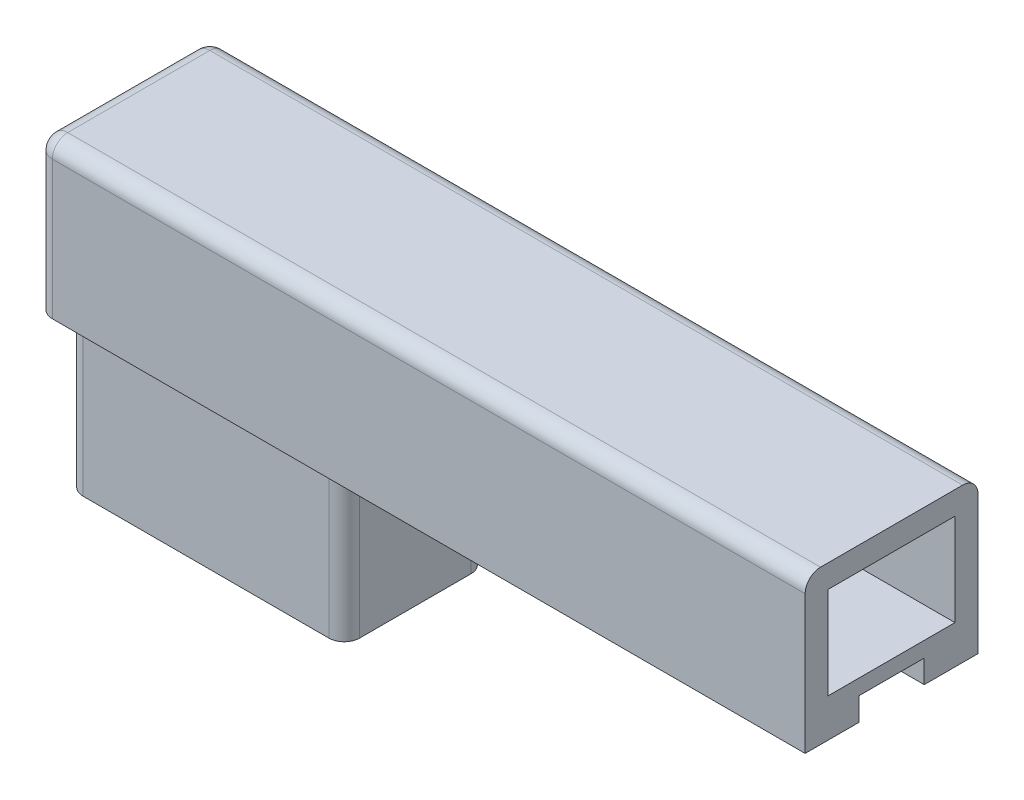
SolidWorks part; units mm, degrees
ref_plane "Ebene vorne" through (0, 0, 0) normal (0, 0, 1) x (1, 0, 0)
ref_plane "Ebene oben" through (0, 0, 0) normal (0, 1, 0) x (1, 0, 0)
ref_plane "Ebene rechts" through (0, 0, 0) normal (1, 0, 0) x (0, 0, -1)
sketch "Skizze1" plane through (0, 0, 0) normal (0, 1, 0) x (1, 0, 0)
  line L1 (160, -22.5) -> (-40, -22.5)
  line L2 (160, -22.5) -> (160, 22.5)
  line L3 (160, 22.5) -> (-40, 22.5)
  line L4 (-40, -22.5) -> (-40, 22.5)
  point P0 (0, 0)
  point P6 (-40, 0)
  dimension "D1" = 45
  dimension "D2" = 200
  dimension "D3" = 40
extrude "Aufsatz-Linear austragen1" add sketch "Skizze1" along normal blind 40
sketch "Skizze2" plane through (0, 0, 0) normal (0, -1, 0) x (1, 0, 0)
  line L0 (-40, -22.5) -> (-40, 22.5) construction
  line L1 (-36, 18.5) -> (36, 18.5)
  line L2 (-36, 18.5) -> (-36, -18.5)
  line L3 (-36, -18.5) -> (36, -18.5)
  line L4 (36, 18.5) -> (36, -18.5)
  point P4 (36, 0)
  dimension "D1" = 37
  dimension "D2" = 72
  dimension "D3" = 4
extrude "Aufsatz-Linear austragen2" add sketch "Skizze2" along normal blind 40
shell "Wandung2" thickness 4
sketch "Skizze4" plane through (0, -40, 0) normal (0, -1, 0) x (1, 0, 0)
  line L0 (-36, -18.5) -> (36, -18.5) construction
  line L1 (36, 18.5) -> (32, 18.5)
  line L2 (36, 18.5) -> (36, -18.5)
  line L3 (36, -18.5) -> (32, -18.5)
  line L4 (32, 18.5) -> (32, -18.5)
  line L5 (32, -14.5) -> (32, 14.5) construction
extrude "Aufsatz-Linear austragen3" add sketch "Skizze4" against normal up to surface (76 mm away)
sketch "Skizze7" plane through (0, 0, 0) normal (0, -1, 0) x (1, 0, 0)
  line L0 (-40, 22.5) -> (160, 22.5) construction
  line L1 (160, -22.5) -> (34, -22.5)
  line L2 (160, -22.5) -> (160, 22.5)
  line L3 (160, 22.5) -> (34, 22.5)
  line L4 (34, -22.5) -> (34, 22.5)
  dimension "D1" = 126
extrude "Aufsatz-Linear austragen4" add sketch "Skizze7" against normal up to next
sketch "Skizze8" plane through (160, 0, 0) normal (1, 0, 0) x (0, 0, -1)
  line L0 (-16.5, 10) -> (16.5, 10)
  line L1 (18.5, 0) -> (-18.5, 0) construction
  line L2 (-22.5, 40) -> (22.5, 40) construction
  line L4 (16.5, 34) -> (-16.5, 10) construction
  line L5 (-16.5, 34) -> (16.5, 10) construction
  line L13 (16.5, 10) -> (16.5, 34)
  line L14 (16.5, 34) -> (-16.5, 34)
  line L15 (-16.5, 34) -> (-16.5, 10)
  point P4 (0, 22)
  point P5 (-16.5822, 34)
  dimension "D1" = 10
  dimension "D2" = 6
  dimension "D3" = 33
extrude "Schnitt-Linear austragen3" cut sketch "Skizze8" against normal blind 45
sketch "Skizze10" plane through (0, 0, 0) normal (0, -1, 0) x (1, 0, 0)
  line L0 (36, -18.5) -> (36, 18.5) construction
  line L1 (36, 8.5) -> (160, 8.5)
  line L2 (36, 8.5) -> (36, -8.5)
  line L3 (36, -8.5) -> (160, -8.5)
  line L4 (160, 8.5) -> (160, -8.5)
  line L5 (36, 8.5) -> (160, -8.5) construction
  line L6 (36, -8.5) -> (160, 8.5) construction
  line L7 (160, 22.5) -> (160, -22.5) construction
  point P0 (98, 0)
  dimension "D1" = 17
extrude "Schnitt-Linear austragen4" cut sketch "Skizze10" against normal blind 6
sketch "Skizze5" plane through (0, 0, 0) normal (1, 0, 0) x (0, 0, -1)
  line L0 (-22.5, 0) -> (-8.5, 0) construction
  line L1 (-8.5, 20) -> (8.5, 20)
  line L2 (-8.5, 20) -> (-8.5, 1)
  line L3 (-8.5, 1) -> (8.5, 1)
  line L4 (8.5, 20) -> (8.5, 1)
  dimension "D1" = 8.5
  dimension "D2" = 8.5
  dimension "D3" = 20
  dimension "D4" = 1
extrude "Schnitt-Linear austragen2" cut sketch "Skizze5" along normal blind 45
fillet "Verrundung1" radius 4 2 edges at (-40, 20, -22.5) (-40, 20, 22.5)
fillet "Verrundung2" radius 4 5 edges at (62, 40, -22.5) (-38.8284, 40, -21.3284) (-40, 40, 0) (-38.8284, 40, 21.3284) (62, 40, 22.5)
fillet "Verrundung3" radius 4 4 edges at (-36, -20, 18.5) (-36, -20, -18.5) (36, -20, -18.5) (36, -20, 18.5)
